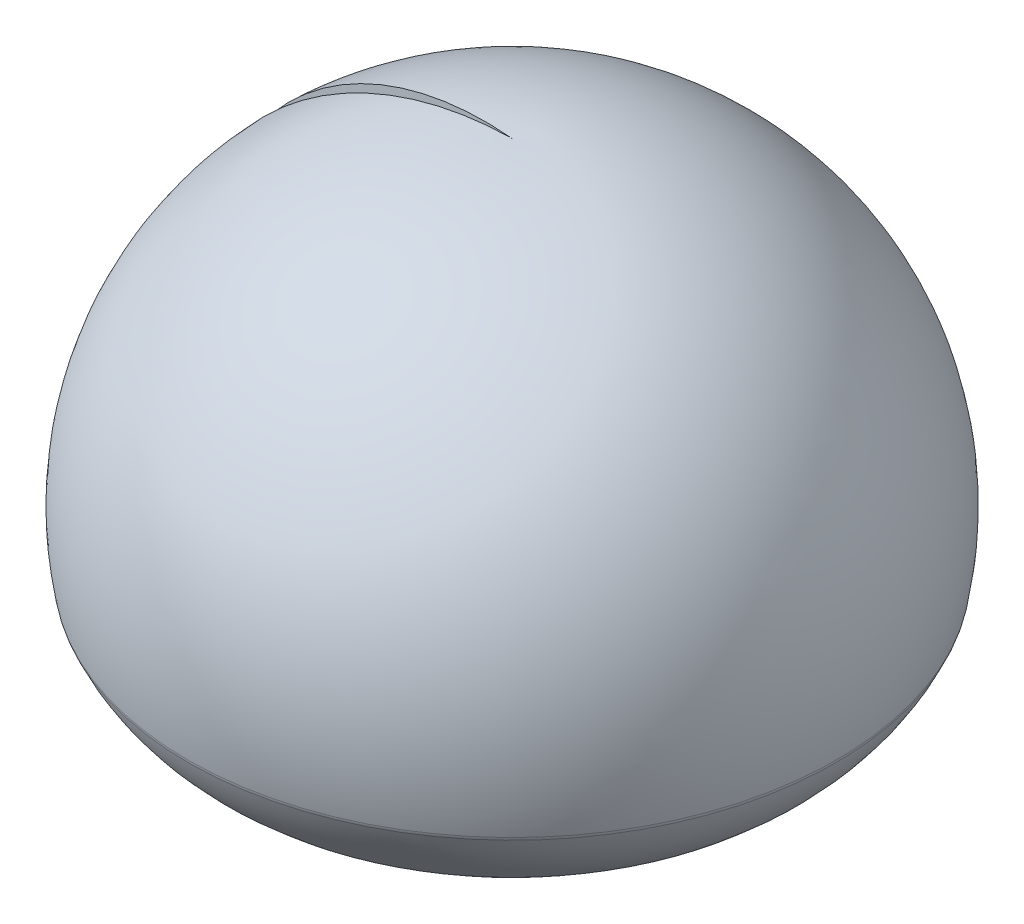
SolidWorks part; units mm, degrees
ref_plane "Ebene vorne" through (0, 0, 0) normal (0, 0, 1) x (1, 0, 0)
ref_plane "Ebene oben" through (0, 0, 0) normal (0, 1, 0) x (1, 0, 0)
ref_plane "Ebene rechts" through (0, 0, 0) normal (1, 0, 0) x (0, 0, -1)
sketch "Arbeitsraum_Konstruktionsskizze" plane through (0, 0, 0) normal (0, 0, 1) x (1, 0, 0)
  line L0 (50, 567) -> (681.458, 611.1558) construction
  line L1 (50, 567) -> (50, 1200) construction
  line L2 (-124.4784, 1175.4787) -> (16.785, 1882.4332) construction
  line L3 (681.458, 611.1558) -> (778.0527, -103.2737) construction
  line L4 (50, 567) -> (0, 0) construction
  line L5 (50, 567) -> (-124.4784, 1175.4787) construction
  line L6 (681.458, 611.1558) -> (160.2493, 113.078) construction
  line L7 (681.458, 611.1558) -> (1343.5936, 325.9952) construction
  line L8 (-124.4784, 1175.4787) -> (554.2559, 1418.5007) construction
  line L9 (-124.4784, 1175.4787) -> (471.0806, 769.2158) construction
  line L12 (1343.5936, 325.9952) -> (1399.3898, 298.9622) construction
  line L14 (16.785, 1882.4332) -> (31.6266, 1942.6306) construction
  line L15 (62.971, 1841.0707) -> (16.785, 1882.4332) construction
  line L16 (-43.5892, 1868.3281) -> (16.785, 1882.4332) construction
  line L17 (160.2493, 113.078) -> (113.564, 72.28) construction
  line L18 (160.2493, 113.078) -> (217.7953, 90.003) construction
  line L19 (160.2493, 113.078) -> (145.0927, 173.1969) construction
  line L20 (471.0806, 769.2158) -> (520.6935, 732.033) construction
  line L21 (471.0806, 769.2158) -> (481.6869, 830.3019) construction
  line L22 (471.0806, 769.2158) -> (414.9599, 742.863) construction
  line L23 (1343.5936, 325.9952) -> (1342.3493, 387.9827) construction
  line L24 (1343.5936, 325.9952) -> (1294.176, 288.5532) construction
  arc A1 (681.458, 611.1558) -> (-124.4784, 1175.4787) centre (50, 567) ccw construction
  arc A4 (160.2493, 113.078) -> (1343.5936, 325.9952) centre (681.458, 611.1558) ccw construction
  arc A5 (471.0806, 769.2158) -> (16.785, 1882.4332) centre (-124.4784, 1175.4787) ccw construction
  arc A6 (62.971, 1841.0707) -> (-43.5892, 1868.3281) centre (16.785, 1882.4332) ccw construction
  arc A10 (1294.176, 288.5532) -> (1342.3493, 387.9827) centre (1343.5936, 325.9952) ccw construction
  arc A14 (414.9599, 742.863) -> (481.6869, 830.3019) centre (471.0806, 769.2158) ccw construction
  arc A23 (145.0927, 173.1969) -> (217.7953, 90.003) centre (160.2493, 113.078) ccw construction
  arc A26 (1404.5448, 314.6396) -> (15.22, 1944.4134) centre (50, 567) ccw
  arc A28 (414.9599, 742.863) -> (62.971, 1841.0707) centre (-124.4784, 1175.4787) ccw
  arc A29 (145.0927, 173.1969) -> (414.9599, 742.863) centre (50, 567) ccw
  arc A30 (115.4254, 70.2433) -> (1400.5373, 301.4714) centre (681.458, 611.1558) ccw
  arc A32 (67.1026, 1846.2097) -> (-43.5892, 1868.3281) centre (-124.4784, 1175.4787) ccw
  text T0 "A1  " font "Century Gothic" height 20
  text T1 "A2" font "Century Gothic" height 20
  text T2 "A3" font "Century Gothic" height 20
  text T3 "A3" font "Century Gothic" height 20
  text T4 "A5" font "Century Gothic" height 20
  text T5 "A5" font "Century Gothic" height 20
  text T6 "A3" font "Century Gothic" height 20
  point P0 (50, 567)
  point P1 (50, 1200)
  dimension "D3" = 93.7
  dimension "D6" = 720.93
  dimension "D7" = 59
  dimension "D10" = 720.93
  dimension "D11" = 177.45
  dimension "D14" = 124
  dimension "D18" = 62
  dimension "D19" = 124
  dimension "D20" = 124
  dimension "D1" = 86
  dimension "D2" = 16
  dimension "D4" = 54
  dimension "D5" = 59
  dimension "D8" = 93.7
  dimension "D9" = 54
  dimension "D13" = 117
  dimension "D15" = 117
  dimension "D16" = 117
  dimension "D17" = 117
  dimension "D21" = 117
  dimension "D22" = 117
  dimension "D24" = 177.45
  dimension "D25" = 177.45
  dimension "D26" = 177.45
sketch "Arbeitsraum" plane through (0, 0, 0) normal (0, 0, 1) x (1, 0, 0)
  arc A1 (145.0927, 173.1969) -> (414.9599, 742.863) centre (50, 567) ccw construction
  arc A2 (145.0927, 173.1969) -> (217.7953, 90.003) centre (160.2493, 113.078) ccw construction
  arc A3 (115.4254, 70.2433) -> (1400.5373, 301.4714) centre (681.458, 611.1558) ccw construction
  arc A4 (1294.176, 288.5532) -> (1342.3493, 387.9827) centre (1343.5936, 325.9952) ccw construction
  arc A5 (414.9599, 742.863) -> (62.971, 1841.0707) centre (-124.4784, 1175.4787) ccw construction
  arc A6 (67.1026, 1846.2097) -> (-43.5892, 1868.3281) centre (-124.4784, 1175.4787) ccw construction
  arc A7 (1404.5448, 314.6396) -> (15.22, 1944.4134) centre (50, 567) ccw construction
  arc A8 (62.971, 1841.0707) -> (-43.5892, 1868.3281) centre (16.785, 1882.4332) ccw construction
  arc A10 (145.0927, 173.1969) -> (414.9599, 742.863) centre (50, 567) ccw
  arc A11 (145.0927, 173.1969) -> (115.4254, 70.2433) centre (160.2493, 113.078) ccw
  arc A12 (115.4254, 70.2433) -> (1400.5373, 301.4714) centre (681.458, 611.1558) ccw
  arc A13 (1400.5373, 301.4714) -> (1404.5448, 314.6396) centre (1343.5936, 325.9952) ccw
  arc A14 (414.9599, 742.863) -> (62.971, 1841.0707) centre (-124.4784, 1175.4787) ccw
  arc A15 (67.1026, 1846.2097) -> (-43.5892, 1868.3281) centre (-124.4784, 1175.4787) ccw
  arc A16 (1404.5448, 314.6396) -> (15.22, 1944.4134) centre (50, 567) ccw
  arc A17 (62.971, 1841.0707) -> (67.1026, 1846.2097) centre (16.785, 1882.4332) ccw
  arc A18 (15.22, 1944.4134) -> (-43.5892, 1868.3281) centre (16.785, 1882.4332) ccw
sketch "Aufsatz_rotiert" plane through (0, 0, 0) normal (0, 0, 1) x (1, 0, 0)
  line L0 (0, 1897.4652) -> (0, 1943.9449)
  line L2 (62.971, 1841.0707) -> (16.785, 1882.4332) construction
  line L3 (62.971, 1841.0707) -> (0, 1897.4652)
  line L4 (0, 0) -> (0, 2517.1747) construction
  arc A2 (1404.5448, 314.6396) -> (15.22, 1944.4134) centre (50, 567) ccw construction
  arc A3 (1294.176, 288.5532) -> (1342.3493, 387.9827) centre (1343.5936, 325.9952) ccw construction
  arc A18 (115.4254, 70.2433) -> (1400.5373, 301.4714) centre (681.458, 611.1558) ccw construction
  arc A19 (145.0927, 173.1969) -> (217.7953, 90.003) centre (160.2493, 113.078) ccw construction
  arc A20 (145.0927, 173.1969) -> (414.9599, 742.863) centre (50, 567) ccw construction
  arc A21 (414.9599, 742.863) -> (62.971, 1841.0707) centre (-124.4784, 1175.4787) ccw construction
  arc A22 (414.9599, 742.863) -> (62.971, 1841.0707) centre (-124.4784, 1175.4787) ccw
  arc A23 (145.0927, 173.1969) -> (414.9599, 742.863) centre (50, 567) ccw
  arc A24 (145.0927, 173.1969) -> (115.4254, 70.2433) centre (160.2493, 113.078) ccw
  arc A25 (115.4254, 70.2433) -> (1400.5373, 301.4714) centre (681.458, 611.1558) ccw
  arc A26 (1400.5373, 301.4714) -> (1404.5448, 314.6396) centre (1343.5936, 325.9952) ccw
  arc A27 (1404.5448, 314.6396) -> (0, 1943.9449) centre (50, 567) ccw
revolve "Arbeitsraum_Kugel" add sketch "Aufsatz_rotiert" angle 177 about L4
